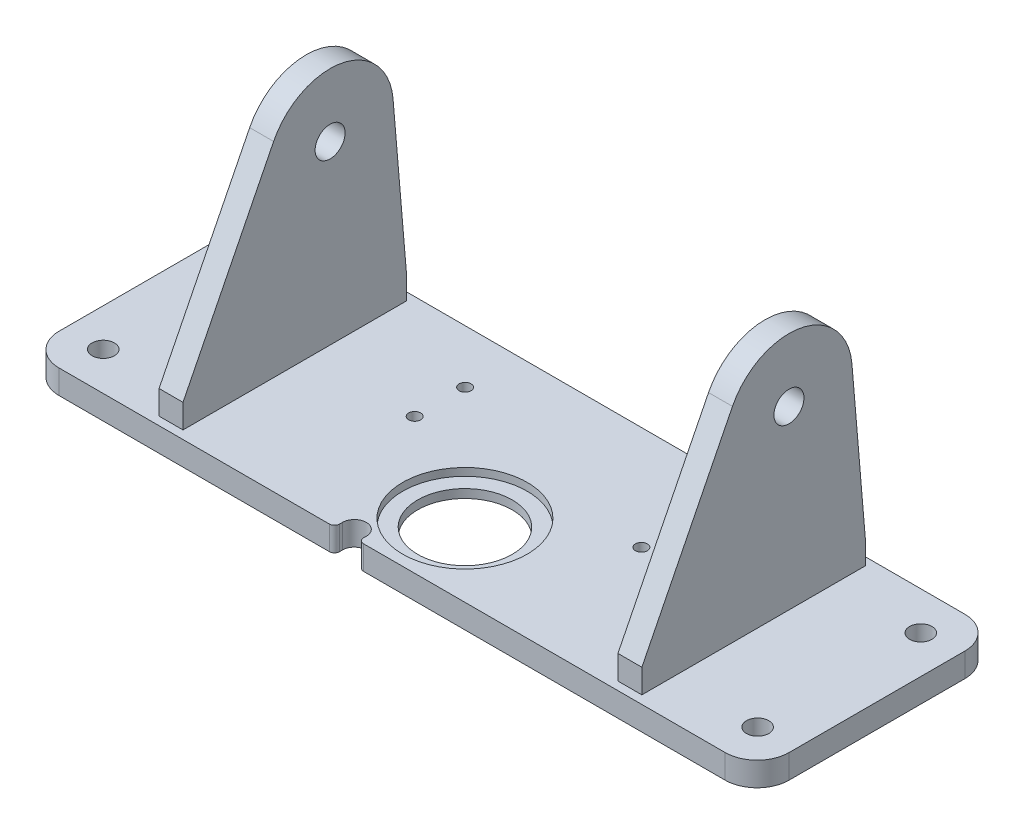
SolidWorks part; units mm, degrees
ref_plane "Front Plane" through (0, 0, 0) normal (0, 0, 1) x (1, 0, 0)
ref_plane "Top Plane" through (0, 0, 0) normal (0, 1, 0) x (1, 0, 0)
ref_plane "Right Plane" through (0, 0, 0) normal (1, 0, 0) x (0, 0, -1)
sketch "Sketch1" plane through (0, 0, 0) normal (0, 1, 0) x (1, 0, 0)
  line L1 (-145.1991, 47.6758) -> (145.1991, 47.6758)
  line L2 (-145.1991, 47.6758) -> (-145.1991, -47.6758)
  line L3 (-145.1991, -47.6758) -> (145.1991, -47.6758)
  line L4 (145.1991, 47.6758) -> (145.1991, -47.6758)
  line L5 (-145.1991, 47.6758) -> (145.1991, -47.6758) construction
  line L6 (-145.1991, -47.6758) -> (145.1991, 47.6758) construction
  circle A0 centre (0, -18.7198) radius 18.796
  point P0 (0, 0)
  point P9 (0, -37.5158)
  dimension "D3" = 37.592
  dimension "D1" = 95.3516
  dimension "D2" = 290.3982
  dimension "D4" = 28.956
extrude "Mounting Plate" add sketch "Sketch1" along normal blind 9.525
sketch "Sketch3" plane through (0, 9.525, 0) normal (0, 1, 0) x (1, 0, 0)
  line L0 (130.175, -32.4612) -> (130.175, 32.4612) construction
  line L1 (145.1991, -47.6758) -> (145.1991, 47.6758) construction
  line L2 (-45.1041, 26.4414) -> (45.1041, 26.4414) construction
  line L3 (145.1991, 47.6758) -> (-145.1991, 47.6758) construction
  line L4 (-130.175, -32.4612) -> (130.175, -32.4612) construction
  line L5 (0, 0) -> (0, -37.5158) construction
  line L6 (-145.1991, -47.6758) -> (145.1991, -47.6758) construction
  line L7 (65.024, -25.8318) -> (77.724, -25.8318) construction
  line L8 (-22.9616, -44.5008) -> (-22.9616, -47.6758)
  line L9 (-13.4366, -44.5008) -> (-13.4366, -47.6758)
  line L10 (-22.9616, -47.6758) -> (-13.4366, -47.6758)
  line L11 (-145.1991, 47.6758) -> (-145.1991, -47.6758) construction
  line L12 (65.024, -25.8318) -> (65.024, -0.4318) construction
  line L13 (65.024, -0.4318) -> (77.724, -0.4318) construction
  line L14 (77.724, -25.8318) -> (77.724, -0.4318) construction
  circle A0 centre (-130.175, 32.4612) radius 4.445
  circle A1 centre (130.175, 32.4612) radius 4.445
  circle A2 centre (130.175, -32.4612) radius 4.445
  circle A3 centre (-130.175, -32.4612) radius 4.445
  circle A4 centre (45.1041, 26.4414) radius 2.3876
  circle A5 centre (45.1041, 6.3754) radius 2.3876
  circle A6 centre (-45.1041, 6.3754) radius 2.3876
  circle A7 centre (-45.1041, 26.4414) radius 2.3876
  arc A9 (-22.9616, -44.5008) -> (-13.4366, -44.5008) centre (-18.1991, -44.5008) cw
  circle A10 centre (0, -18.7198) radius 18.796 construction
  point P8 (145.1991, 0)
  point P11 (130.175, 0)
  point P20 (0, -32.4612)
  point P24 (0, 26.4414)
  dimension "D1" = 8.89
  dimension "D2" = 8.89
  dimension "D3" = 8.89
  dimension "D4" = 8.89
  dimension "D6" = 20.066
  dimension "D8" = 4.7752
  dimension "D9" = 4.7752
  dimension "D10" = 4.7752
  dimension "D11" = 4.7752
  dimension "D14" = 3.175
  dimension "D17" = 12.7
  dimension "D5" = 64.9224
  dimension "D7" = 90.2081
  dimension "D12" = 21.2344
  dimension "D13" = 260.35
  dimension "D15" = 122.2375
  dimension "D16" = 9.525
  dimension "D19" = 21.844
  dimension "D20" = 25.4
extrude "Mounting holes" cut sketch "Sketch3" against normal through all
fillet "corner radii" radius 12.7 4 edges at (-145.1991, 4.7625, -47.6758) (-145.1991, 4.7625, 47.6758) (145.1991, 4.7625, -47.6758) (145.1991, 4.7625, 47.6758)
sketch "Sketch5" plane through (0, 9.525, 0) normal (0, 1, 0) x (1, 0, 0)
  line L0 (132.4991, 47.6758) -> (-132.4991, 47.6758) construction
  line L1 (-96.0437, 47.6758) -> (-86.5187, 47.6758)
  line L2 (-96.0437, 47.6758) -> (-96.0437, -47.6758)
  line L3 (-96.0437, -47.6758) -> (-86.5187, -47.6758)
  line L4 (-86.5187, 47.6758) -> (-86.5187, -47.6758)
  line L5 (-132.4991, -47.6758) -> (-22.9616, -47.6758) construction
  line L6 (0, 0) -> (0, 47.6758) construction
  line L7 (132.4991, 47.6758) -> (-132.4991, 47.6758) construction
  line L8 (86.5187, 47.6758) -> (86.5187, -47.6758)
  line L9 (96.0437, -47.6758) -> (86.5187, -47.6758)
  line L10 (96.0437, 47.6758) -> (96.0437, -47.6758)
  line L11 (96.0437, 47.6758) -> (86.5187, 47.6758)
  dimension "D1" = 9.525
  dimension "D2" = 86.5187
extrude "Upright tabs" add sketch "Sketch5" along normal offset from surface (95.25 mm away) 104.775 separate body
sketch "Sketch6" plane through (96.0437, 0, 0) normal (1, 0, 0) x (0, 0, -1)
  line L0 (-44.3738, 19.05) -> (-8.3287, 90.9042)
  line L1 (-47.6758, 104.775) -> (47.6758, 104.775) construction
  line L2 (44.5262, 19.05) -> (39.2037, 81.7558)
  line L13 (-47.6758, 9.525) -> (47.6758, 9.525) construction
  line L14 (47.6758, 104.775) -> (47.6758, 9.525) construction
  line L15 (-44.3738, 19.05) -> (44.5262, 19.05) construction
  line L16 (-44.3738, 19.05) -> (-44.3738, 9.525)
  line L17 (-34.9758, 9.525) -> (-47.6758, 9.525) construction
  line L18 (-44.3738, 9.525) -> (-47.6758, 9.525)
  line L19 (-47.6758, 9.525) -> (-47.6758, 110.6128)
  line L21 (-47.6758, 110.6128) -> (47.6758, 110.6128)
  line L22 (47.6758, 110.6128) -> (47.6758, 9.525)
  line L23 (47.6758, 9.525) -> (44.5262, 9.525)
  line L24 (44.5262, 9.525) -> (44.5262, 19.05)
  circle A0 centre (14.1478, 79.629) radius 5.969
  arc A1 (39.2037, 81.7558) -> (-8.3287, 90.9042) centre (14.1478, 79.629) ccw
  point P1 (0.0762, 19.05)
  point P2 (0, 0)
  dimension "D1" = 11.938
  dimension "D4" = 9.525
  dimension "D2" = 79.629
  dimension "D3" = 33.528
  dimension "D7" = 88.9
extrude "Pole Bolt hole (ream to size)" cut sketch "Sketch6" against normal through all
fillet "Fillet3" radius 2.032 2 edges at (-13.4366, 4.7625, 47.6758) (-22.9616, 4.7625, 47.6758)
sketch "Sketch7" plane through (0, 0, 0) normal (0, -1, 0) x (1, 0, 0)
  circle A0 centre (0, 18.7198) radius 24.765
  dimension "D1" = 49.53
extrude "seal bellow bottom cut" cut sketch "Sketch7" against normal blind 3.048
sketch "Sketch8" plane through (0, 9.525, 0) normal (0, 1, 0) x (1, 0, 0)
  circle A0 centre (0, -18.7198) radius 24.765
  dimension "D1" = 49.53
extrude "seal bellow top cut" cut sketch "Sketch8" against normal blind 3.048
